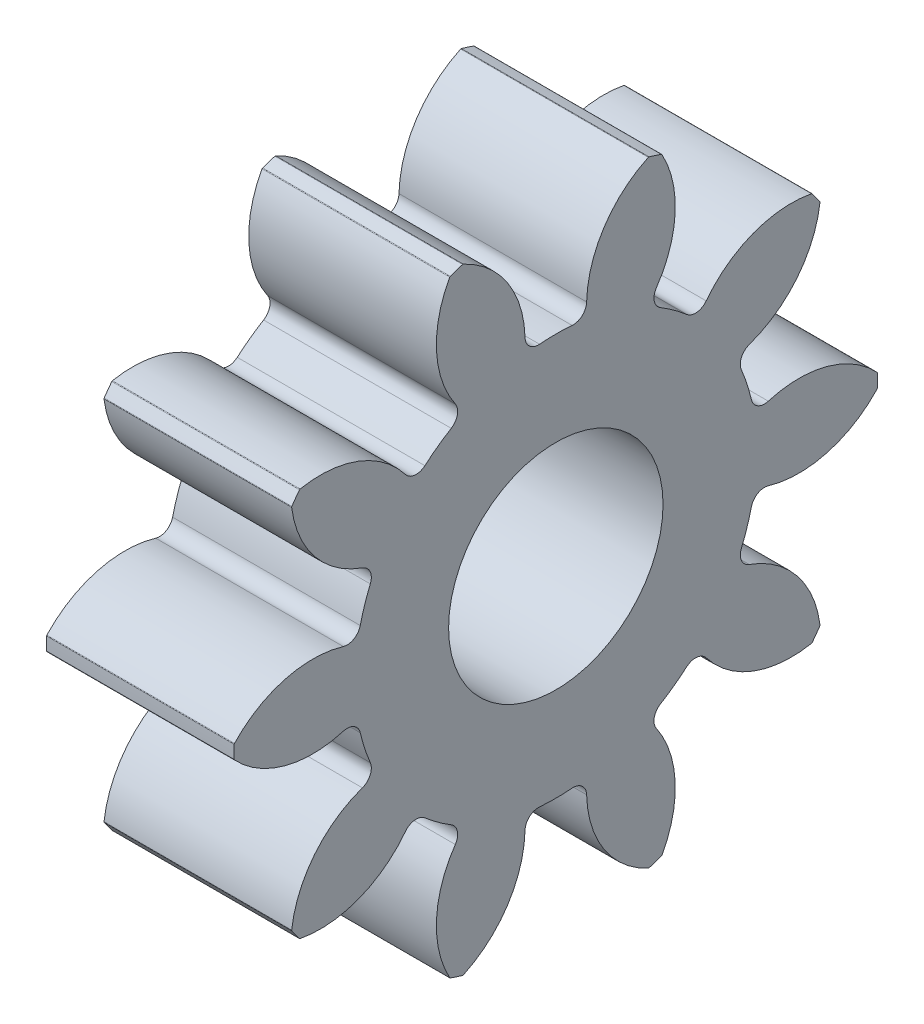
SolidWorks part; units mm, degrees
ref_plane "Plane1" through (0, 0, 0) normal (0, 0, 1) x (1, 0, 0)
ref_plane "Plane2" through (0, 0, 0) normal (0, 1, 0) x (1, 0, 0)
ref_plane "Plane3" through (0, 0, 0) normal (1, 0, 0) x (0, 0, -1)
sketch "HoldingSke" plane through (0, 0, 0) normal (0, 1, 0) x (1, 0, 0)
  line L0 (0, 0) -> (0.4924, -0.0868)
  line L1 (-15, 0) -> (100, 0) construction
  line L2 (0, 0) -> (-2.1039, 2.3779)
  line L3 (0, 0) -> (-11.863, 4.5341)
  line L4 (0, 0) -> (8.5048, 1.4996)
  line L5 (0, 0) -> (-46.8476, -17.4728)
  line L6 (0, 0) -> (-5.8027, -3.9151)
  line L7 (-2.1039, 2.3779) -> (8.6586, 51.2059)
  line L8 (-76.2, 54.61) -> (-76.1, 54.61)
  line L9 (-71.009, 38.7566) -> (-53.1078, 45.2721)
  line L10 (-76.2, 71.12) -> (104.1128, 71.12)
  line L11 (0, 0) -> (-7, 0)
  line L12 (-76.2, 101.6) -> (-76.133, 101.6)
  line L13 (24.9733, 27.94) -> (52.9518, 28.4284)
  line L14 (24.9733, 27.94) -> (24.9743, 27.94)
  line L15 (24.9733, 27.94) -> (100.4006, 29.5858)
  line L16 (-63.627, -2) -> (-12.827, -2)
  circle A0 centre (0, 0) radius 0.4
  circle A1 centre (0, 0) radius 7.499
  circle A2 centre (0, 0) radius 37.5
  circle A3 centre (0, 0) radius 0.4
  dimension "MHD" = 14.998
  dimension "Hub_dia" = 75
  dimension "Bore" = 0.8
  dimension "MBD" = 0.8
  dimension "Num_teeth" = 10
  dimension "Pitch_radius" = 180.3128
  dimension "Pitch" = 0.5
  dimension "Width" = 7
  dimension "Overall_len" = 50
  dimension "Show_teeth" = 10
  dimension "Thickness" = 7
  dimension "OAL" = 50.0001
  dimension "T_dim" = 0.1
  dimension "Ap" = 20
  dimension "H" = 19.05
  dimension "Backlash" = 0.067
  dimension "Addendum_fac" = 1
  dimension "Dedendum_fac" = 1.25
  dimension "Clearance_fac" = 0.25
  dimension "Dedendum_add" = 0.001
  dimension "Module" = 2
sketch "BasProSke" plane through (0, 0, 0) normal (0, 1, 0) x (1, 0, 0)
  line L0 (-10, 0) -> (60, 0) construction
  line L1 (0, 0) -> (0, 12)
  line L2 (0, 0) -> (7, 0)
  line L3 (7, 0) -> (7, 12)
  line L4 (7, 12) -> (0, 12)
  dimension "Diameter" = 24
  dimension "Thickness" = 7
revolve "Base-Revolve" add sketch "BasProSke" angle 360 about L0
sketch "TooCutSke" plane through (0, 0, 0) normal (1, 0, 0) x (0, 0, -1)
  line L1 (0, 0) -> (0, 107) construction
  line L2 (0, 0) -> (-1.6814, 9.8576) construction
  line L3 (0, 0) -> (-6.1153, 18.8209) construction
  line L4 (-1.6814, 9.8576) -> (-3.0576, 9.4105) construction
  arc A0 (1.1737, 7.4066) -> (-1.1737, 7.4066) centre (0, 0) ccw
  arc A1 (3.4979, 11.5054) -> (-3.4979, 11.5054) centre (0, 0) ccw
  circle A2 centre (0, 0) radius 10 construction
  circle A3 centre (0, 0) radius 9.3969 construction
  arc A4 (-1.1737, 7.4066) -> (-3.4979, 11.5054) centre (-5.1477, 7.8615) ccw
  arc A5 (3.4979, 11.5054) -> (1.1737, 7.4066) centre (5.1477, 7.8615) ccw
  dimension "Root_dia" = 14.998
  dimension "Overcut_dia" = 24.0508
  dimension "Pitch_dia" = 20
  dimension "Base_dia" = 18.7939
  dimension "Flank_rad" = 4
  dimension "Half_ang" = 18
  dimension "Half_CT" = 1.4471
extrude "ToothCut" cut sketch "TooCutSke" along normal through all
fillet "Breaks" radius 0.04 2 edges at (3.5, 11.4894, -3.463) (3.5, 11.4894, 3.463)
fillet "RootFillets" radius 0.501 2 edges at (3.5, 7.4066, -1.1737) (3.5, 7.4066, 1.1737)
pattern_circular "TeethCuts" count 10 every 36 about axis through (-10, 0, 0) along (1, 0, 0) of "ToothCut", "RootFillets", "Breaks"
sketch "HubNeaOneSke" plane through (0, 0, 0) normal (-1, 0, 0) x (0, 0, 1)
  circle A0 centre (0, 0) radius 7.499
  dimension "Diameter" = 14.998
extrude "HubNearOne" [suppressed] add sketch "HubNeaOneSke" along normal blind 43.0001
sketch "HubNeaBotSke" plane through (0, 0, 0) normal (-1, 0, 0) x (0, 0, 1)
  circle A0 centre (0, 0) radius 7.499
  dimension "Diameter" = 14.998
extrude "HubNearBoth" [suppressed] add sketch "HubNeaBotSke" along normal blind 21.5
ref_plane "FarPln" through (7, 0, 0) normal (1, 0, 0) x (0, 0, -1)
sketch "HubFarSke" plane through (7, 0, 0) normal (1, 0, 0) x (0, 0, -1)
  circle A0 centre (0, 0) radius 7.499
  dimension "Diameter" = 14.998
extrude "HubFar" [suppressed] add sketch "HubFarSke" along normal blind 21.5
sketch "BorSke" plane through (0, 0, 0) normal (1, 0, 0) x (0, 0, -1)
  circle A0 centre (0, 0) radius 0.4
  dimension "Diameter" = 0.8
extrude "Bore" cut sketch "BorSke" along normal mid plane 100.0001
sketch "KeySke" plane through (0, 0, 0) normal (1, 0, 0) x (0, 0, -1)
  line L0 (-0.05, 0) -> (-0.05, 0.5)
  line L1 (-0.05, 0.5) -> (0.05, 0.5)
  line L2 (0.05, 0.5) -> (0.05, 0)
  line L3 (0, 0) -> (0, 34) construction
  line L4 (-0.05, 0) -> (0.05, 0)
  dimension "Offset" = 0.5
  dimension "Width" = 0.1
extrude "Keyway" [suppressed] cut sketch "KeySke" along normal mid plane 100.0001
pattern_circular "Keyway2" [suppressed] count 2 every 90 about axis through (-10, 0, 0) along (1, 0, 0)
sketch "草图1" plane through (0, 0, 0) normal (-1, 0, 0) x (0, 0, 1)
  circle A0 centre (0, 0) radius 4
  dimension "D1" = 8
extrude "切除-拉伸1" cut sketch "草图1" against normal through all
equation "' \"Module@HoldingSke\" = 6.35"
equation "' \"Num_teeth@HoldingSke\" = 12"
equation "' \"Ap@HoldingSke\" =  20"
equation "' \"Width@HoldingSke\" = 0.5 * 25.4"
equation "' \"Hub_dia@HoldingSke\"= 1 * 25.4"
equation "' \"Overall_len@HoldingSke\" = 1.0 * 25.4"
equation "' \"Bore@HoldingSke\" = 0.75 * 25.4"
equation "' \"T_dim@HoldingSke\" = 0.1 * 25.4"
equation "' \"Width@KeySke\" = 0.25 * 25.4"
equation "' \"Show_teeth@HoldingSke\" = 13"
equation "' \"Backlash@HoldingSke\" = 0.009 * 25.4"
equation "' \"Addendum_fac@HoldingSke\" = 1.0"
equation "' \"Dedendum_fac@HoldingSke\" = 1.25"
equation "' \"Dedendum_add@HoldingSke\" = 0.00005 * 25.4"
equation "' \"Clearance_fac@HoldingSke\" = 0.25"
equation "\"Pitch@HoldingSke\" = 1 / \"Module@HoldingSke\""
equation "\"Overcut_dia@TooCutSke\" = (\"Num_teeth@HoldingSke\" + 2 * \"Addendum_fac@HoldingSke\") / \"Pitch@HoldingSke\" + 0.002 * 25.4"
equation "\"Pitch_dia@TooCutSke\" = \"Num_teeth@HoldingSke\" / \"Pitch@HoldingSke\""
equation "\"Base_dia@TooCutSke\" = \"Num_teeth@HoldingSke\" / \"Pitch@HoldingSke\" * cos((\"Ap@HoldingSke\"  * 3.14159265 / 180))"
equation "\"Root_dia@TooCutSke\" = (\"Num_teeth@HoldingSke\" + 2) / \"Pitch@HoldingSke\" - 2 * (\"Addendum_fac@HoldingSke\" + \"Dedendum_fac@HoldingSke\") / \"Pitch@HoldingSke\" - \"Dedendum_add@HoldingSke\" * 2"
equation "\"Half_ang@TooCutSke\" = 180 / \"Num_teeth@HoldingSke\""
equation "\"Half_CT@TooCutSke\" = \"Num_teeth@HoldingSke\" / \"Pitch@HoldingSke\" * sin((3.14159265 / 2 / \"Num_teeth@HoldingSke\")) / 2 - 7 * \"Backlash@HoldingSke\" / 4"
equation "\"Flank_rad@TooCutSke\" = \"Num_teeth@HoldingSke\" / \"Pitch@HoldingSke\" / 5"
equation "\"Radius@RootFillets\" = \"Clearance_fac@HoldingSke\" / \"Pitch@HoldingSke\" + \"Dedendum_add@HoldingSke\""
equation "\"Break_rad@Breaks\" = 0.02 / \"Pitch@HoldingSke\""
equation "\"Thickness@HoldingSke\" = \"Width@HoldingSke\""
equation "\"OAL@HoldingSke\" = \"Thickness@HoldingSke\""
equation "\"MHD@HoldingSke\" = (\"Num_teeth@HoldingSke\" + 2) / \"Pitch@HoldingSke\" - 2 * (\"Addendum_fac@HoldingSke\" + \"Dedendum_fac@HoldingSke\")  / \"Pitch@HoldingSke\" - \"Dedendum_add@HoldingSke\" * 2"
equation "\"MBD@HoldingSke\" = (\"Num_teeth@HoldingSke\" + 2) / \"Pitch@HoldingSke\" - 2 * (\"Addendum_fac@HoldingSke\" + \"Dedendum_fac@HoldingSke\")  / \"Pitch@HoldingSke\" - \"Dedendum_add@HoldingSke\" * 2 - 0.002 * 25.4"
equation "\"MHD@HoldingSke\" = ((sgn( \"MHD@HoldingSke\" - \"Hub_dia@HoldingSke\" )-1)*( \"MHD@HoldingSke\" - \"Hub_dia@HoldingSke\" ))/-2+ \"Hub_dia@HoldingSke\""
equation "\"MBD@HoldingSke\" = ((sgn( \"MBD@HoldingSke\" - \"Bore@HoldingSke\" )-1)*( \"MBD@HoldingSke\" - \"Bore@HoldingSke\" ))/-2+ \"Bore@HoldingSke\""
equation "\"OAL@HoldingSke\" = ((sgn( \"OAL@HoldingSke\" - \"Overall_len@HoldingSke\" )+1)*( \"OAL@HoldingSke\" - \"Overall_len@HoldingSke\" ))/2 + \"Overall_len@HoldingSke\" + 0.000002 * 25.4"
equation "\"Num_teeth@TeethCuts\" = int( \"Show_teeth@HoldingSke\" ) + 1"
equation "\"Num_teeth@TeethCuts\" = ((sgn( \"Num_teeth@TeethCuts\" - \"Num_teeth@HoldingSke\" )-1)*( \"Num_teeth@TeethCuts\" - \"Num_teeth@HoldingSke\" ))/-2+ \"Num_teeth@HoldingSke\""
equation "\"Num_teeth@TeethCuts\" = ((sgn( \"Num_teeth@TeethCuts\" - 2.0)+1)*( \"Num_teeth@TeethCuts\" - 2.0))/2 +2.0"
equation "\"Angle@TeethCuts\" = 360.0 / \"Num_teeth@HoldingSke\""
equation "\"Diameter@BasProSke\" = (\"Num_teeth@HoldingSke\" + 2 * \"Addendum_fac@HoldingSke\") / \"Pitch@HoldingSke\""
equation "\"Thickness@BasProSke\"  = \"Thickness@HoldingSke\""
equation "' \"Fillet_rad@BasProSke\" =  \"Thickness@HoldingSke\" * 0.05"
equation "\"MHD@HoldingSke\" = ((sgn( \"MHD@HoldingSke\" - \"Root_dia@TooCutSke\" )-1)*( \"MHD@HoldingSke\" - \"Root_dia@TooCutSke\" ))/-2+ \"Root_dia@TooCutSke\""
equation "\"Diameter@HubNeaOneSke\" = \"MHD@HoldingSke\""
equation "\"Length@HubNearOne\" = \"OAL@HoldingSke\" - \"Thickness@BasProSke\""
equation "\"Diameter@HubNeaBotSke\" = \"MHD@HoldingSke\""
equation "\"Length@HubNearBoth\" = ( \"OAL@HoldingSke\" - \"Thickness@BasProSke\" ) / 2.0"
equation "\"Thickness@FarPln\" = \"Thickness@BasProSke\""
equation "\"Diameter@HubFarSke\" = \"MHD@HoldingSke\""
equation "\"Length@HubFar\" = ( \"OAL@HoldingSke\" - \"Thickness@BasProSke\" ) / 2.0"
equation "\"Diameter@BorSke\" = \"MBD@HoldingSke\""
equation "\"D1@Bore\" = \"OAL@HoldingSke\" * 2.0"
equation "\"D1@Keyway\" = \"OAL@HoldingSke\" * 2.0"
equation "\"Offset@KeySke\" = \"T_dim@HoldingSke\" + \"MBD@HoldingSke\" / 2.0"
